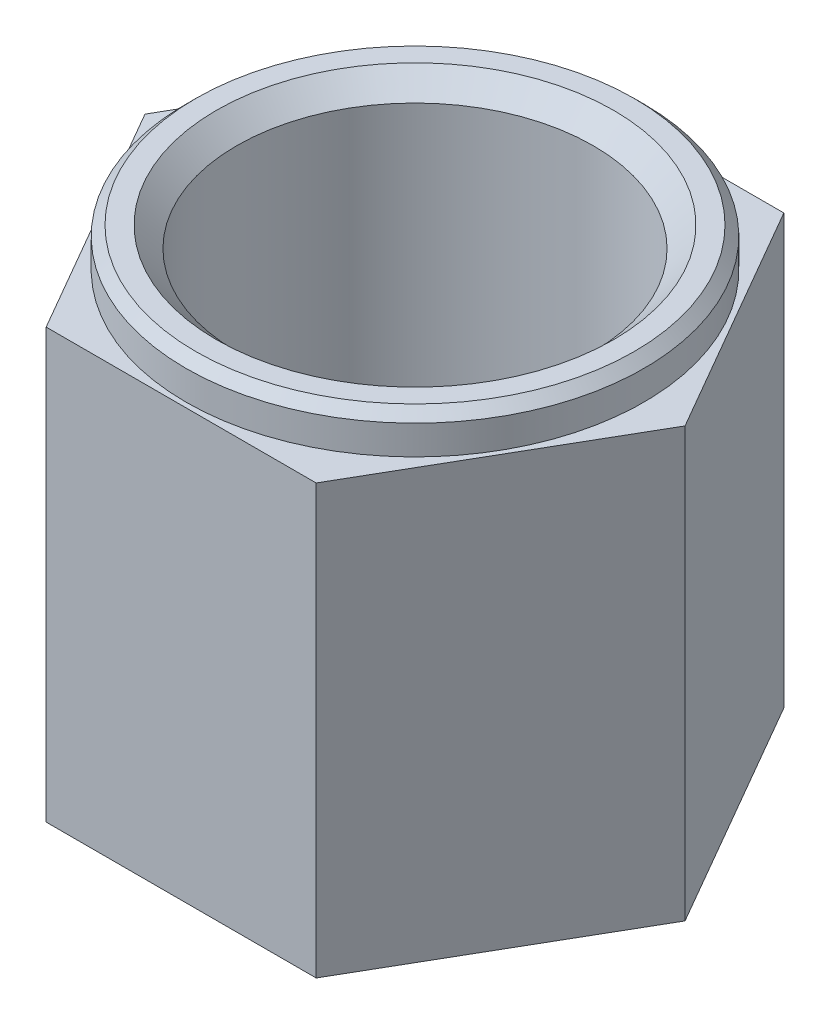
SolidWorks part; units mm, degrees
ref_plane "Přední rovina" through (0, 0, 0) normal (0, 0, 1) x (1, 0, 0)
ref_plane "Horní rovina" through (0, 0, 0) normal (0, 1, 0) x (1, 0, 0)
ref_plane "Pravá rovina" through (0, 0, 0) normal (1, 0, 0) x (0, 0, -1)
sketch "Skica1" plane through (0, 0, 0) normal (0, 1, 0) x (1, 0, 0)
  line L1 (13.8564, 0) -> (6.9282, 12)
  line L2 (6.9282, 12) -> (-6.9282, 12)
  line L3 (-6.9282, 12) -> (-13.8564, 0)
  line L4 (-13.8564, 0) -> (-6.9282, -12)
  line L5 (-6.9282, -12) -> (6.9282, -12)
  line L6 (6.9282, -12) -> (13.8564, 0)
  circle A0 centre (0, 0) radius 12 construction
extrude "Přidat vysunutím1" add sketch "Skica1" along normal blind 24
sketch "Skica2" plane through (0, 0, 0) normal (1, 0, 0) x (0, 0, -1)
  line L0 (0, 0) -> (-7, 0)
  line L1 (0, 0) -> (-12, 0) construction
  line L2 (-7, 0) -> (-7, 3.5)
  line L3 (-7, 3.5) -> (-7.5, 4)
  line L4 (-7.5, 4) -> (-9.6, 4)
  line L5 (-10.1, 4.5) -> (-10.1, 7.8)
  line L6 (-9.9976, 8.1031) -> (-9.1476, 8.9531)
  line L7 (-9.1476, 8.9531) -> (-9.1476, 22.9531)
  line L8 (-9.1476, 22.9531) -> (-10.1945, 24)
  line L9 (0, 24) -> (-12, 24) construction
  line L10 (-10.1945, 24) -> (0, 24)
  line L11 (0, 24) -> (0, 0) construction
  line L12 (0, 24) -> (0, 0) construction
  line L13 (0, 0) -> (0, 24)
  arc A0 (-9.6, 4) -> (-10.1, 4.5) centre (-9.6, 4.5) cw
  arc A1 (-10.1, 7.8) -> (-9.9976, 8.1031) centre (-9.6, 7.8) cw
  dimension "D5" = 0.5
  dimension "D7" = 0.5
  dimension "D1" = 3.5
  dimension "D2" = 0.5
  dimension "D3" = 0.5
  dimension "D4" = 2.1
  dimension "D6" = 3.3
  dimension "D8" = 0.85
  dimension "D9" = 0.85
  dimension "D10" = 14
  dimension "D11" = 1.0469
  dimension "D12" = 135
  dimension "D13" = 7
revolve "Odebrat rotací1" cut sketch "Skica2" angle 360 about L12
sketch "Skica3" plane through (0, 0, 0) normal (1, 0, 0) x (0, 0, -1)
  line L0 (-16.75, 22) -> (-11.75, 22)
  line L2 (-11.75, 22) -> (-11.75, 24)
  line L3 (0, 24) -> (-12, 24) construction
  line L4 (0, 24) -> (0, 10.1865) construction
  line L5 (10.1945, 24) -> (-10.1945, 24) construction
  line L6 (-16.75, 22) -> (-16.75, 24)
  line L7 (-16.75, 24) -> (-11.75, 24)
  dimension "D1" = 2
  dimension "D2" = 5
revolve "Odebrat rotací3" cut sketch "Skica3" angle 360 about L4
chamfer "Zkosení1" distance 0.5 angle 45 1 edges at (0, 24, 11.75)
